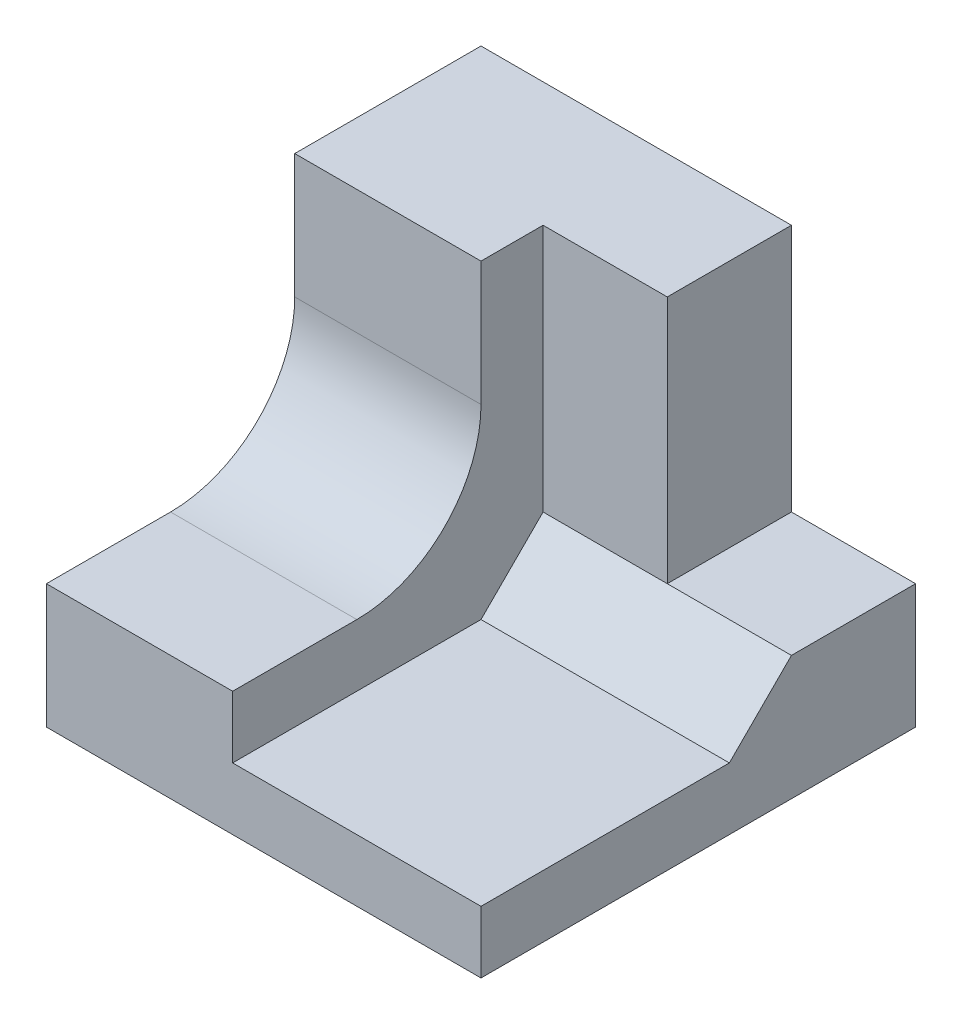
SolidWorks part; units mm, degrees
ref_plane "正面" through (0, 0, 0) normal (0, 0, 1) x (1, 0, 0)
ref_plane "平面" through (0, 0, 0) normal (0, 1, 0) x (1, 0, 0)
ref_plane "右側面" through (0, 0, 0) normal (1, 0, 0) x (0, 0, -1)
sketch "ｽｹｯﾁ1" plane through (0, 0, 0) normal (0, 1, 0) x (1, 0, 0)
  line L1 (0, 0) -> (70, 0)
  line L2 (0, 0) -> (0, 70)
  line L3 (0, 70) -> (70, 70)
  line L4 (70, 0) -> (70, 70)
  dimension "D1" = 70
  dimension "D2" = 70
extrude "押し出し1" add sketch "ｽｹｯﾁ1" along normal blind 60
sketch "ｽｹｯﾁ2" plane through (0, 60, 0) normal (0, 1, 0) x (1, 0, 0)
  line L0 (70, 70) -> (0, 70) construction
  line L1 (70, 0) -> (30, 0)
  line L2 (70, 0) -> (70, 50)
  line L3 (70, 50) -> (30, 50)
  line L4 (30, 0) -> (30, 50)
  line L5 (0, 70) -> (0, 0) construction
  dimension "D1" = 20
  dimension "D2" = 30
extrude "ｶｯﾄ - 押し出し1" cut sketch "ｽｹｯﾁ2" against normal offset from surface (50 mm away) 10
sketch "ｽｹｯﾁ3" plane through (30, 0, 0) normal (1, 0, 0) x (0, 0, -1)
  line L0 (0, 0) -> (70, 0) construction
  line L1 (0, 60) -> (40, 60)
  line L2 (0, 60) -> (0, 20)
  line L3 (0, 20) -> (40, 20)
  line L4 (40, 60) -> (40, 20)
  line L5 (70, 60) -> (70, 0) construction
  dimension "D1" = 20
  dimension "D2" = 30
extrude "ｶｯﾄ - 押し出し2" cut sketch "ｽｹｯﾁ3" against normal through all
sketch "ｽｹｯﾁ4" plane through (0, 0, -50) normal (0, 0, 1) x (1, 0, 0)
  line L0 (0, 0) -> (70, 0) construction
  line L1 (70, 60) -> (50, 60)
  line L2 (70, 60) -> (70, 20)
  line L3 (70, 20) -> (50, 20)
  line L4 (50, 60) -> (50, 20)
  line L5 (0, 20) -> (0, 60) construction
  dimension "D1" = 20
  dimension "D2" = 50
extrude "ｶｯﾄ - 押し出し3" cut sketch "ｽｹｯﾁ4" against normal through all
chamfer "面取り1" distance 10 angle 45 1 edges at (50, 10, -50)
fillet "ﾌｨﾚｯﾄ1" radius 20 1 edges at (15, 20, -40)
